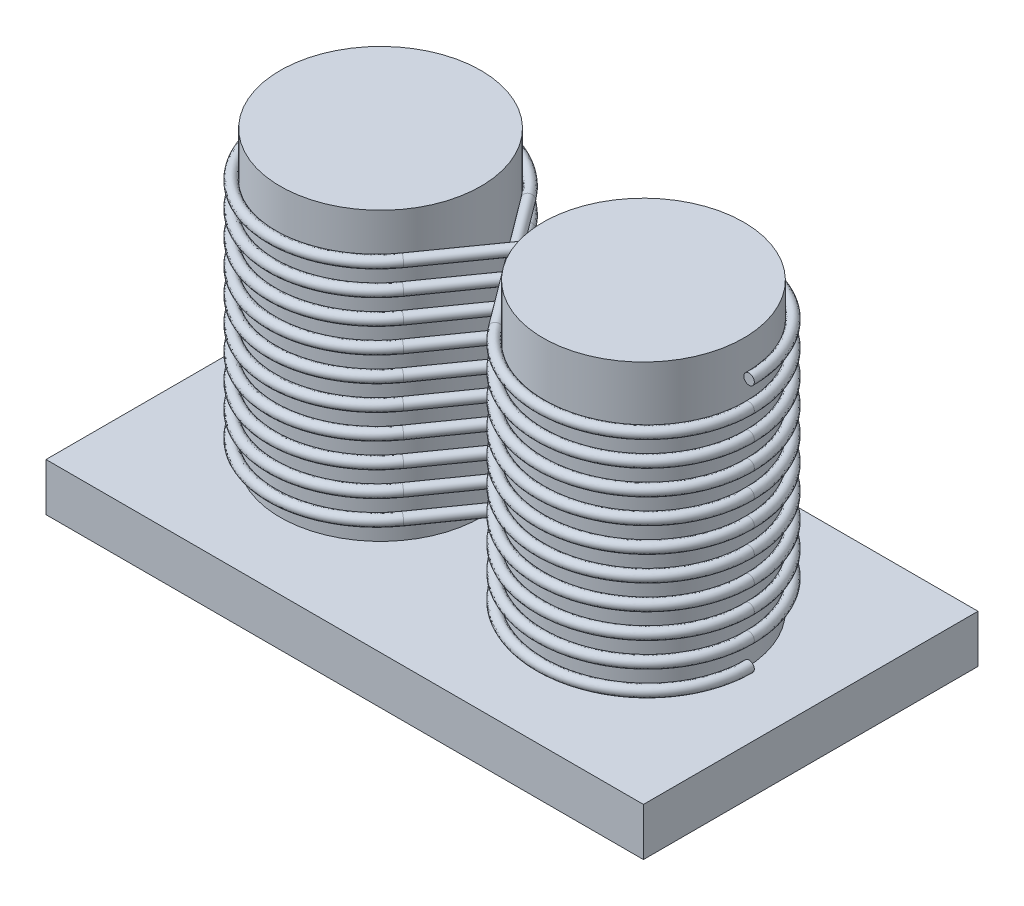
SolidWorks part; units mm, degrees
ref_plane "Ebene vorne" through (0, 0, 0) normal (0, 0, 1) x (1, 0, 0)
ref_plane "Ebene oben" through (0, 0, 0) normal (0, 1, 0) x (1, 0, 0)
ref_plane "Ebene rechts" through (0, 0, 0) normal (1, 0, 0) x (0, 0, -1)
sketch "Skizze9" plane through (0, 0, 0) normal (0, 1, 0) x (1, 0, 0)
  line L1 (-62.5, -35) -> (62.5, -35)
  line L2 (-62.5, -35) -> (-62.5, 35)
  line L3 (-62.5, 35) -> (62.5, 35)
  line L4 (62.5, -35) -> (62.5, 35)
  line L5 (-62.5, -35) -> (62.5, 35) construction
  line L6 (-62.5, 35) -> (62.5, -35) construction
  point P0 (0, 0)
  dimension "D1" = 70
  dimension "D2" = 125
extrude "Linear austragen3" add sketch "Skizze9" against normal blind 10
sketch "Skizze10" plane through (0, 0, 0) normal (0, 1, 0) x (1, 0, 0)
  circle A0 centre (27.5, 0) radius 21
  circle A1 centre (-27.5, 0) radius 21
  dimension "D1" = 42
  dimension "D2" = 42
  dimension "D3" = 27.5
  dimension "D4" = 27.5
extrude "Linear austragen4" add sketch "Skizze10" along normal blind 60
sketch "Skizze11" plane through (0, 0, 0) normal (0, 0, 1) x (1, 0, 0)
  line L0 (0, 0) -> (0, 14.7544)
  point P3 (0, 1.1)
  point P4 (0, 2.4)
  point P5 (0, 3.7)
  point P6 (0, 5)
  point P7 (0, 6.3)
  dimension "D1" = 1.1
  dimension "D2" = 1.3
  dimension "D3" = 2.6
  dimension "D4" = 1.3
  dimension "D5" = 2.6
ref_plane "Ebene5" through (0, 1.1, 0) normal (0, 1, 0) x (-1, 0, 0)
sketch "Skizze12" plane through (0, 1.1, 0) normal (0, 1, 0) x (-1, 0, 0)
  line L0 (-9.7396, 13.1522) -> (9.7396, -13.1522)
  line L1 (9.7396, 13.1522) -> (-9.7396, -13.1522)
  circle A0 centre (-27.5, 0) radius 22.1
  circle A1 centre (27.5, 0) radius 22.1
  point P9 (49.6, 0)
  point P12 (-49.6, 0)
  dimension "D1" = 44.2
  dimension "D2" = 44.2
sketch "Skizze13" plane through (0, 1.1, 0) normal (0, 1, 0) x (-1, 0, 0)
  line L0 (-9.7396, 13.1522) -> (9.7396, -13.1522) construction
  line L1 (9.7396, 13.1522) -> (-9.7396, -13.1522) construction
  line L2 (-9.7396, 13.1522) -> (9.7396, -13.1522)
  line L3 (9.7396, 13.1522) -> (-9.7396, -13.1522)
  circle A0 centre (-27.5, 0) radius 22.1 construction
  circle A1 centre (27.5, 0) radius 22.1 construction
  arc A2 (-9.7396, 13.1522) -> (-9.7396, -13.1522) centre (-27.5, 0) ccw
  arc A3 (9.7396, -13.1522) -> (9.7396, 13.1522) centre (27.5, 0) ccw
surface "Oberfläche-Linear austragen1" sketch "Skizze13" parameters "D1"=20
sketch3d "3D-Skizze5"
  line L0 (-49.6, 3.7, 20.3392) -> (-49.6, 3.7, -20.3392)
  line L1 (49.6, 6.3, 20.7701) -> (49.6, 6.3, -20.7701)
  point P0 (49.6, 1.1, 0)
  point P4 (-49.6, 3.7, 0)
  point P9 (49.6, 6.3, 0)
  point P21 (49.6, 6.3, 0)
  point P22 (-49.6, 3.7, 0)
ref_plane "Ebene8" through (0.0629, 2.3984, 0) normal (-0.0262, -0.9997, 0) x (0.9997, -0.0262, 0)
ref_plane "Ebene9" through (-0.131, 4.9966, 0) normal (0.0262, -0.9997, 0) x (0.9997, 0.0262, 0)
sketch3d "3D-Skizze13"
  line L2 (0, 2.4, 0) -> (9.7396, 2.1447, 13.1522)
  line L3 (0, 2.4, 0) -> (9.7396, 2.1447, 13.1522)
  line L4 (-9.7396, 2.6553, -13.1522) -> (0, 2.4, 0)
  line L5 (-9.7396, 2.6553, -13.1522) -> (0, 2.4, 0)
  spline S0 degree 3 poles (9.7396, 3.5511, -13.1522) (25.0959, 2.6068, -33.8889) (49.6, 1.1, -25.8036) (49.6, 1.1, 0) knots 0 0 0 0 1 1 1 1 weights 1 0.542227 0.542227 1
  spline S1 degree 3 poles (49.6, 1.1, 0) (49.6, 1.1, 25.8036) (25.0959, 1.7422, 33.8889) (9.7396, 2.1447, 13.1522) knots 0 0 0 0 1 1 1 1 weights 1 0.542227 0.542227 1
  spline S2 degree 3 poles (49.6, 1.1, 0) (49.6, 1.1, 25.8036) (25.0959, 1.7422, 33.8889) (9.7396, 2.1447, 13.1522) knots 0 0 0 0 1 1 1 1 weights 1 0.542227 0.542227 1
  spline S4 degree 3 poles (-9.7396, 2.6553, 13.1522) (-25.0959, 3.0578, 33.8889) (-49.6, 3.7, 25.8036) (-49.6, 3.7, 0) (-49.6, 3.7, -25.8036) (-25.0959, 3.0578, -33.8889) (-9.7396, 2.6553, -13.1522) knots 0 0 0 0 0.5 0.5 0.5 1 1 1 1 weights 1 0.542227 0.542227 1 0.542227 0.542227 1
  spline S6 degree 3 poles (-49.6, 3.7, 0) (-49.6, 3.7, -25.8036) (-25.0959, 3.0578, -33.8889) (-9.7396, 2.6553, -13.1522) knots 0.5 0.5 0.5 0.5 1 1 1 1 weights 1 0.542227 0.542227 1
sketch3d "3D-Skizze14"
  line L0 (0, 5, 0) -> (-9.7396, 4.7447, 13.1522)
  line L1 (0, 5, 0) -> (-9.7396, 4.7447, 13.1522)
  line L2 (9.7396, 5.2553, -13.1522) -> (0, 5, 0)
  line L3 (9.7396, 5.2553, -13.1522) -> (0, 5, 0)
  spline S0 degree 3 poles (-9.7396, 4.7447, 13.1522) (-25.0959, 4.3422, 33.8889) (-49.6, 3.7, 25.8036) (-49.6, 3.7, 0) (-49.6, 3.7, -25.8036) (-25.0959, 4.3422, -33.8889) (-9.7396, 4.7447, -13.1522) knots 0 0 0 0 0.5 0.5 0.5 1 1 1 1 weights 1 0.542227 0.542227 1 0.542227 0.542227 1
  spline S1 degree 3 poles (-9.7396, 4.7447, 13.1522) (-25.0959, 4.3422, 33.8889) (-49.6, 3.7, 25.8036) (-49.6, 3.7, 0) knots 0 0 0 0 0.5 0.5 0.5 0.5 weights 1 0.542227 0.542227 1
  spline S2 degree 3 poles (9.7396, 5.2553, -13.1522) (25.0959, 5.6578, -33.8889) (49.6, 6.3, -25.8036) (49.6, 6.3, 0) (49.6, 6.3, 25.8036) (25.0959, 5.6578, 33.8889) (9.7396, 5.2553, 13.1522) knots 0 0 0 0 0.5 0.5 0.5 1 1 1 1 weights 1 0.542227 0.542227 1 0.542227 0.542227 1
  spline S3 degree 3 poles (9.7396, 5.2553, -13.1522) (25.0959, 5.6578, -33.8889) (49.6, 6.3, -25.8036) (49.6, 6.3, 0) knots 0 0 0 0 0.5 0.5 0.5 0.5 weights 1 0.542227 0.542227 1
ref_plane "Ebene11" through (49.6, 1.1, 0) normal (0, 0, 1) x (1, 0, 0)
sketch "Skizze15" plane through (49.6, 1.1, 0) normal (0, 0, 1) x (1, 0, 0)
  circle A0 centre (0, 0) radius 1.1
  dimension "D1" = 2.2
ref_plane "Ebene12" through (49.6, 6.3, 0) normal (0, 0, 1) x (1, 0, 0)
sketch "Skizze16" plane through (49.6, 6.3, 0) normal (0, 0, 1) x (1, 0, 0)
  circle A0 centre (0, 0) radius 1.1
  dimension "D1" = 2.2
sweep "Austragung12" add profiles "Skizze15" path "3D-Skizze13"
sweep "Austragung13" add profiles "Skizze16" path "3D-Skizze14"
pattern_linear "Lineares Muster1" count 10 spacing 5.2 along (0, 1, 0)
equation "\"Zylinder_Durchmesser\"= 42"
equation "\"Zylinder_Abstand\"= 13"
equation "\"POF_Durchmesser\"= 2.2"
equation "\"POF_Abstand\"= 3"
equation "\"D1@Skizze9\" = \"Zylinder_Durchmesser\"+28"
equation "\"D2@Skizze9\" = 2*\"Zylinder_Durchmesser\"+\"Zylinder_Abstand\"+28"
equation "\"D1@Skizze10\" = \"Zylinder_Durchmesser\""
equation "\"D2@Skizze10\" = \"Zylinder_Durchmesser\""
equation "\"D3@Skizze10\" = (\"Zylinder_Durchmesser\" + \"Zylinder_Abstand\")/2"
equation "\"D4@Skizze10\" = (\"Zylinder_Durchmesser\" + \"Zylinder_Abstand\")/2"
equation "\"D1@Skizze11\" = \"POF_Durchmesser\"/2"
equation "\"D3@Skizze11\" =  (\"POF_Durchmesser\"+\"POF_Abstand\")/2"
equation "\"D2@Skizze11\" = \"D3@Skizze11\"/2"
equation "\"D5@Skizze11\" = \"D3@Skizze11\""
equation "\"D4@Skizze11\" = \"D3@Skizze11\"/2"
equation "\"D1@Skizze12\" = \"Zylinder_Durchmesser\" + \"POF_Durchmesser\""
equation "\"D2@Skizze12\" = \"D1@Skizze12\""
equation "\"D1@Skizze15\" = \"POF_Durchmesser\""
equation "\"D1@Skizze16\" = \"POF_Durchmesser\""
